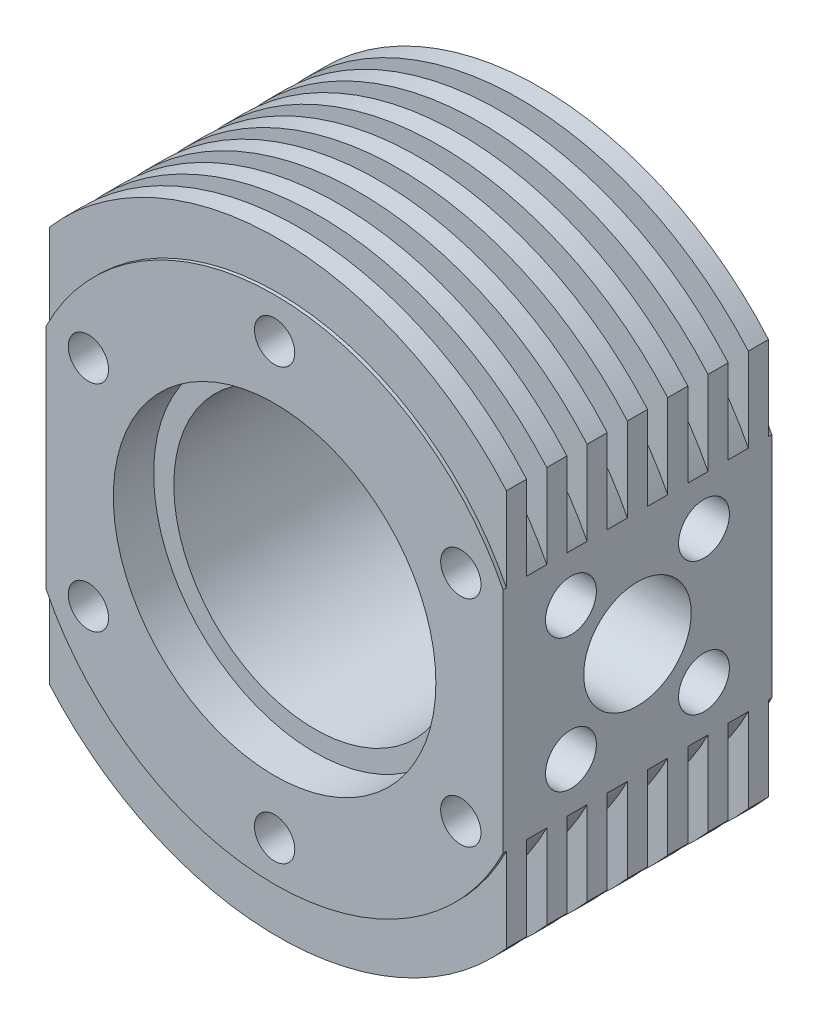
SolidWorks part; units mm, degrees
ref_plane "Front Plane" through (0, 0, 0) normal (0, 0, 1) x (1, 0, 0)
ref_plane "Top Plane" through (0, 0, 0) normal (0, 1, 0) x (1, 0, 0)
ref_plane "Right Plane" through (0, 0, 0) normal (1, 0, 0) x (0, 0, -1)
sketch "Sketch1" plane through (0, 0, 0) normal (0, 0, 1) x (1, 0, 0)
  line L2 (17, -14.7394) -> (17, 14.7394)
  line L4 (-17, -14.7394) -> (-17, 14.7394)
  line L5 (13.2662, -18.173) -> (-13.2662, 18.173) construction
  line L6 (13.2662, 18.173) -> (-13.2662, -18.173) construction
  arc A0 (-17, -14.7394) -> (17, -14.7394) centre (0, 0) ccw
  arc A1 (17, 14.7394) -> (-17, 14.7394) centre (0, 0) ccw
  circle A2 centre (0, 0) radius 10.5
  dimension "D1" = 45
  dimension "D2" = 21
extrude "Boss-Extrude1" add sketch "Sketch1" along normal blind 20
sketch "Sketch2" plane through (0, 0, 20) normal (0, 0, 1) x (1, 0, 0)
  circle A0 centre (0, 0) radius 12
  dimension "D1" = 24
extrude "Cut-Extrude1" cut sketch "Sketch2" against normal blind 3
sketch "Sketch4" plane through (0, 0, 0) normal (0, 0, -1) x (-1, 0, 0)
  circle A0 centre (0, 0) radius 19
  dimension "D1" = 38
extrude "Cut-Extrude2" cut sketch "Sketch4" against normal blind 0.25 flip side to cut
sketch "Sketch5" plane through (0, 0, 20) normal (0, 0, 1) x (1, 0, 0)
  circle A0 centre (0, 0) radius 19
  dimension "D1" = 38
extrude "Cut-Extrude3" cut sketch "Sketch5" against normal blind 0.25 flip side to cut
ref_plane "Plane1" through (0, 0, 18.25) normal (0, 0, 1) x (1, 0, 0)
sketch "Sketch6" plane through (0, 0, 18.25) normal (0, 0, 1) x (1, 0, 0)
  line L0 (17, 8.4853) -> (17, 14.7394) construction
  line L1 (17, 8.4853) -> (17, 14.7394)
  line L2 (-17, 14.7394) -> (-17, 8.4853) construction
  line L3 (-17, 14.7394) -> (-17, 8.4853)
  arc A0 (17, 8.4853) -> (-17, 8.4853) centre (0, 0) ccw construction
  arc A1 (17, 14.7394) -> (-17, 14.7394) centre (0, 0) ccw construction
  arc A2 (17, 8.4853) -> (-17, 8.4853) centre (0, 0) ccw
  arc A3 (17, 14.7394) -> (-17, 14.7394) centre (0, 0) ccw
extrude "Cut-Extrude4" cut sketch "Sketch6" against normal blind 1.5
pattern_linear "LPattern1" count 6 spacing 3 along (0, 0, -1) of "Cut-Extrude4"
mirror "Mirror1" about plane through (0, 0, 0) normal (0, 1, 0) of "LPattern1", "Cut-Extrude4"
sketch "Sketch9" plane through (17, 0, 0) normal (1, 0, 0) x (0, 0, -1)
  circle A0 centre (-10, 0) radius 4
  dimension "D2" = 8
  dimension "D1" = 10
extrude "Cut-Extrude5" cut sketch "Sketch9" against normal up to next
sketch "Sketch10" plane through (17, 0, 0) normal (1, 0, 0) x (0, 0, -1)
  line L0 (-10, 0) -> (-3, 0) construction
  line L1 (-10, 0) -> (-5.0503, 4.9497) construction
  line L2 (-10, 0) -> (-10, -7) construction
  circle A0 centre (-10, 0) radius 7 construction
  circle A1 centre (-5.0503, 4.9497) radius 1.8925
  circle A2 centre (-5.0503, -4.9497) radius 1.8925
  circle A3 centre (-14.9497, -4.9497) radius 1.8925
  circle A4 centre (-14.9497, 4.9497) radius 1.8925
  dimension "D1" = 14
  dimension "D3" = 3.785
  dimension "D2" = 45
extrude "Cut-Extrude6" cut sketch "Sketch10" against normal blind 4
ref_plane "Plane2" through (0, 0, 10) normal (0, 0, 1) x (1, 0, 0)
sketch "Sketch11" plane through (0, 0, 10) normal (0, 0, 1) x (1, 0, 0)
  line L0 (-17, 0) -> (-11.5, 0)
  line L1 (-17, 8.4853) -> (-17, -8.4853) construction
  line L2 (-11.5, 0) -> (-14.5, -3)
  line L3 (-14.5, -3) -> (-17, -3)
  line L4 (-17, 0) -> (-17, -3)
  dimension "D1" = 2.5
  dimension "D2" = 3
  dimension "D3" = 45
revolve "Cut-Revolve1" cut sketch "Sketch11" angle 360 about L0
mirror "Mirror2" about plane through (0, 0, 0) normal (1, 0, 0) of "Cut-Extrude6"
sketch "Sketch12" plane through (0, 0, 20) normal (0, 0, 1) x (1, 0, 0)
  circle A0 centre (0, 0) radius 16 construction
  circle A1 centre (0, 16) radius 1.5
  circle A2 centre (13.8564, 8) radius 1.5
  circle A3 centre (13.8564, -8) radius 1.5
  circle A4 centre (0, -16) radius 1.5
  circle A5 centre (-13.8564, -8) radius 1.5
  circle A6 centre (-13.8564, 8) radius 1.5
  point P17 (0, 0)
  dimension "D1" = 32
  dimension "D2" = 3
  dimension "D3" = 6
extrude "Cut-Extrude7" cut sketch "Sketch12" against normal blind 4
mirror "Mirror3" about plane through (0, 0, 10) normal (0, 0, 1) of "Cut-Extrude7"
